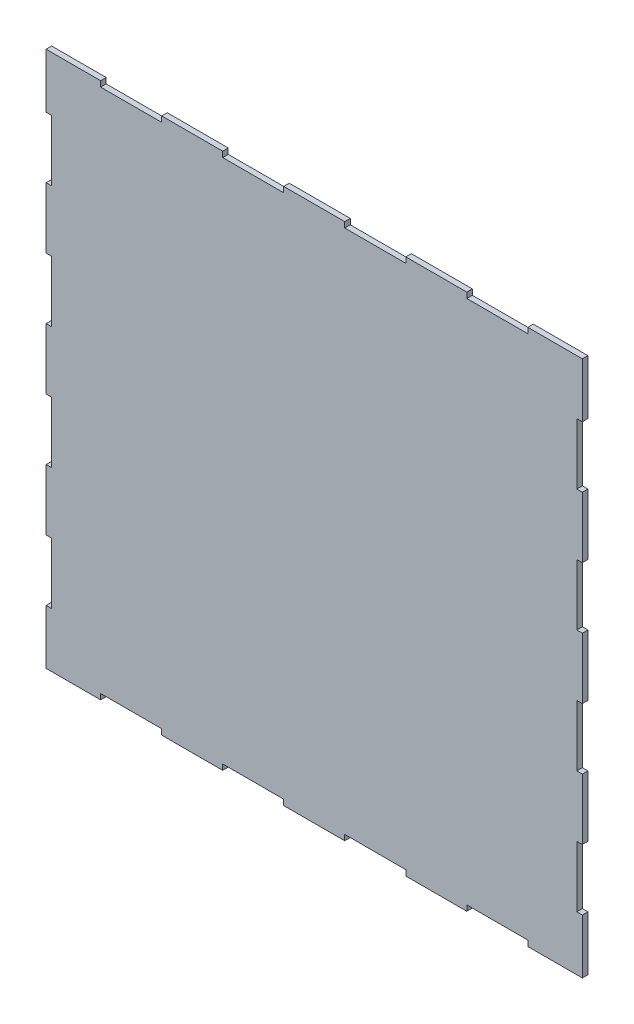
SolidWorks part; units mm, degrees
ref_plane "Front Plane" through (0, 0, 0) normal (0, 0, 1) x (1, 0, 0)
ref_plane "Top Plane" through (0, 0, 0) normal (0, 1, 0) x (1, 0, 0)
ref_plane "Right Plane" through (0, 0, 0) normal (1, 0, 0) x (0, 0, -1)
sketch "Sketch1" plane through (0, 0, 0) normal (0, 0, 1) x (1, 0, 0)
  line L0 (0, 293) -> (0, 263.5)
  line L1 (0, 263.5) -> (3, 263.5)
  line L2 (3, 263.5) -> (3, 230.5)
  line L3 (3, 230.5) -> (0, 230.5)
  line L4 (0, 230.5) -> (0, 197.5)
  line L5 (0, 197.5) -> (3, 197.5)
  line L6 (3, 197.5) -> (3, 164.5)
  line L7 (3, 164.5) -> (0, 164.5)
  line L8 (0, 164.5) -> (0, 131.5)
  line L9 (0, 131.5) -> (3, 131.5)
  line L10 (3, 131.5) -> (3, 98.5)
  line L11 (3, 98.5) -> (0, 98.5)
  line L12 (0, 98.5) -> (0, 65.5)
  line L13 (0, 65.5) -> (3, 65.5)
  line L14 (3, 65.5) -> (3, 32.5)
  line L15 (3, 32.5) -> (0, 32.5)
  line L16 (0, 32.5) -> (0, 3)
  line L17 (0, 3) -> (29.5, 3)
  line L18 (29.5, 3) -> (29.5, 6)
  line L19 (29.5, 6) -> (62.5, 6)
  line L20 (62.5, 6) -> (62.5, 3)
  line L21 (62.5, 3) -> (95.5, 3)
  line L22 (95.5, 3) -> (95.5, 6)
  line L23 (95.5, 6) -> (128.5, 6)
  line L24 (128.5, 6) -> (128.5, 3)
  line L25 (128.5, 3) -> (161.5, 3)
  line L26 (161.5, 3) -> (161.5, 6)
  line L27 (161.5, 6) -> (194.5, 6)
  line L28 (194.5, 6) -> (194.5, 3)
  line L29 (194.5, 3) -> (227.5, 3)
  line L30 (227.5, 3) -> (227.5, 6)
  line L31 (227.5, 6) -> (260.5, 6)
  line L32 (260.5, 6) -> (260.5, 3)
  line L33 (260.5, 3) -> (290, 3)
  line L34 (290, 3) -> (290, 32.5)
  line L35 (290, 32.5) -> (287, 32.5)
  line L36 (287, 32.5) -> (287, 65.5)
  line L37 (287, 65.5) -> (290, 65.5)
  line L38 (290, 65.5) -> (290, 98.5)
  line L39 (290, 98.5) -> (287, 98.5)
  line L40 (287, 98.5) -> (287, 131.5)
  line L41 (287, 131.5) -> (290, 131.5)
  line L42 (290, 131.5) -> (290, 164.5)
  line L43 (290, 164.5) -> (287, 164.5)
  line L44 (287, 164.5) -> (287, 197.5)
  line L45 (287, 197.5) -> (290, 197.5)
  line L46 (290, 197.5) -> (290, 230.5)
  line L47 (290, 230.5) -> (287, 230.5)
  line L48 (287, 230.5) -> (287, 263.5)
  line L49 (287, 263.5) -> (290, 263.5)
  line L50 (290, 263.5) -> (290, 293)
  line L51 (290, 293) -> (260.5, 293)
  line L52 (260.5, 293) -> (260.5, 290)
  line L53 (260.5, 290) -> (227.5, 290)
  line L54 (227.5, 290) -> (227.5, 293)
  line L55 (227.5, 293) -> (194.5, 293)
  line L56 (194.5, 293) -> (194.5, 290)
  line L57 (194.5, 290) -> (161.5, 290)
  line L58 (161.5, 290) -> (161.5, 293)
  line L59 (161.5, 293) -> (128.5, 293)
  line L60 (128.5, 293) -> (128.5, 290)
  line L61 (128.5, 290) -> (95.5, 290)
  line L62 (95.5, 290) -> (95.5, 293)
  line L63 (95.5, 293) -> (62.5, 293)
  line L64 (62.5, 293) -> (62.5, 290)
  line L65 (62.5, 290) -> (29.5, 290)
  line L66 (29.5, 290) -> (29.5, 293)
  line L67 (29.5, 293) -> (0, 293)
  dimension "D1" = 3
  dimension "D2" = 29.5
  dimension "D3" = 62.5
  dimension "D4" = 290
  dimension "D5" = 3
extrude "Boss-Extrude1" add sketch "Sketch1" along normal blind 3
